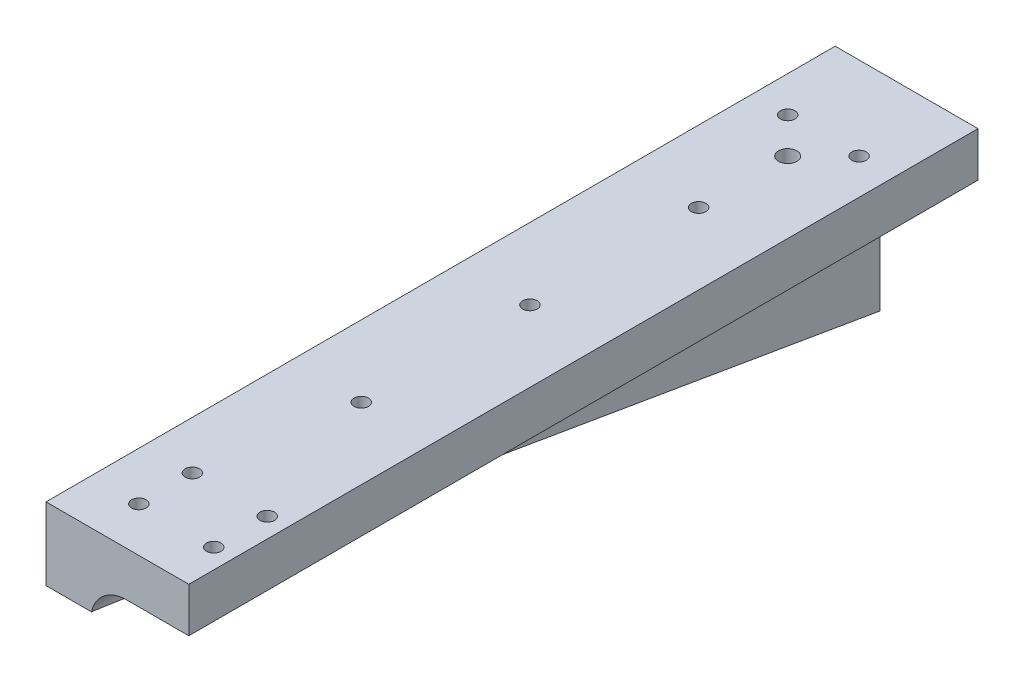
SolidWorks part; units mm, degrees
ref_plane "Front" through (0, 0, 0) normal (0, 0, 1) x (1, 0, 0)
ref_plane "Top" through (0, 0, 0) normal (0, 1, 0) x (1, 0, 0)
ref_plane "Right" through (0, 0, 0) normal (1, 0, 0) x (0, 0, -1)
sketch "Sketch1" plane through (0, 0, 0) normal (0, 0, 1) x (1, 0, 0)
  line L1 (-12.7, 3.9624) -> (12.7, 3.9624)
  line L2 (-12.7, 3.9624) -> (-12.7, -3.9751)
  line L3 (-12.7, -3.9751) -> (12.7, -3.9751)
  line L4 (12.7, 3.9624) -> (12.7, -3.9751)
  point P4 (0, -3.9751)
  dimension "D1" = 7.9375
  dimension "D2" = 25.4
  dimension "D3" = 3.9624
extrude "Extrude1" add sketch "Sketch1" along normal blind 169.545
sketch "Sketch2" plane through (0, 0, 0) normal (0, 0, -1) x (-1, 0, 0)
  line L0 (-12.7, 3.9624) -> (12.7, 3.9624) construction
  line L1 (-9.0043, 3.9624) -> (9.0043, 3.9624)
  line L2 (-9.0043, 3.9624) -> (-9.0043, 2.6924)
  line L3 (-9.0043, 2.6924) -> (9.0043, 2.6924)
  line L4 (9.0043, 3.9624) -> (9.0043, 2.6924)
  point P4 (0, 2.6924)
  dimension "D1" = 1.27
  dimension "D2" = 18.0086
extrude "Cut-Extrude1" [suppressed] cut sketch "Sketch2" against normal through all
sketch "Sketch3" plane through (-12.7, 0, 0) normal (-1, 0, 0) x (0, 0, 1)
  line L0 (0, -3.9751) -> (0, -32.8676)
  line L1 (0, -32.8676) -> (169.545, -3.9751)
  line L2 (169.545, -3.9751) -> (0, -3.9751)
  line L3 (169.545, 3.9624) -> (0, 3.9624) construction
  dimension "D1" = 36.83
extrude "Extrude2" add sketch "Sketch3" against normal blind 7.9375
fillet "Fillet1" radius 6.35 1 edges
hole_wizard "#8-32 Tapped Hole1" positions "Sketch5" profile "Sketch4" tap size "#8-32" standard "Ansi Inch"
sketch "Sketch5" plane through (0, 0, 0) normal (0, 0, -1) x (-1, 0, 0)
  line L1 (-12.7, -3.9751) -> (-12.7, 3.9624) construction
  line L2 (4.7625, -32.8676) -> (12.7, -32.8676) construction
  line L3 (12.7, 3.9624) -> (12.7, -32.8676) construction
  point P0 (8.7376, 0)
  point P1 (8.7376, -25.2476)
  point P2 (-8.7376, 0)
  dimension "D1" = 3.9624
  dimension "D2" = 7.62
  dimension "D3" = 3.9624
sketch "Sketch4" plane through (-8.7376, 0, 0) normal (1, 0, 0) x (0, 1, 0)
  line L0 (0, 0) -> (0, 10.7086)
  line L1 (0, 10.7086) -> (1.7272, 10.7086)
  line L2 (1.7272, 10.7086) -> (1.7272, 0)
  line L5 (1.7272, 0) -> (0, 0)
  line L10 (0, 10.7086) -> (-1.7272, 10.7086) construction
  line L11 (0, -6.35) -> (0, 107.95) construction
  dimension "Tap Drill Dia." = 3.4544
  dimension "Tap Drill Depth" = 10.7086
  dimension "Drill Angle" = 180
hole_wizard "#5-40 Tapped Hole1" positions "Sketch7" profile "Sketch6" tap size "#5-40" standard "Ansi Inch"
sketch "Sketch7" plane through (-12.7, 0, 0) normal (-1, 0, 0) x (0, 0, 1)
  point P0 (6.5456, -4.4958)
  dimension "D1" = 6.5456
  dimension "D2" = 4.4958
sketch "Sketch6" plane through (-12.7, -4.4958, 6.5456) normal (0, 1, 0) x (0, 0, 1)
  line L0 (0, 0) -> (0, 11.5695)
  line L1 (0, 11.5695) -> (1.289, 10.795)
  line L2 (1.289, 10.795) -> (1.289, 0)
  line L5 (1.289, 0) -> (0, 0)
  line L10 (0, 11.5695) -> (-1.2891, 10.795) construction
  line L11 (0, -6.35) -> (0, 107.95) construction
  dimension "Tap Drill Dia." = 2.5781
  dimension "Tap Drill Depth" = 10.795
  dimension "Drill Angle" = 118
hole_wizard "#5-40 Tapped Hole2" positions "Sketch9" profile "Sketch8" tap size "#5-40" standard "Ansi Inch"
sketch "Sketch9" plane through (0, 3.9624, 0) normal (0, 1, 0) x (-1, 0, 0)
  line L0 (-9.2075, 132.445) -> (4.1275, 132.445) construction
  line L1 (4.1275, 132.445) -> (4.1275, 122.92) construction
  line L2 (4.1275, 122.92) -> (-9.2075, 122.92) construction
  line L3 (-9.2075, 122.92) -> (-9.2075, 132.445) construction
  line L5 (-12.7, 169.545) -> (-12.7, 0) construction
  line L8 (-12.7, 169.545) -> (12.7, 169.545) construction
  point P0 (-9.2075, 132.445)
  point P1 (4.1275, 132.445)
  point P2 (4.1275, 122.92)
  point P3 (-9.2075, 122.92)
  dimension "D1" = 9.525
  dimension "D2" = 13.335
  dimension "D3" = 3.4925
  dimension "D4" = 37.1
sketch "Sketch8" plane through (9.2075, 3.9624, 132.445) normal (1, 0, 0) x (0, 0, 1)
  line L0 (0, 0) -> (0, 36.83)
  line L1 (0, 36.83) -> (1.289, 36.83)
  line L2 (1.289, 36.83) -> (1.289, 0)
  line L5 (1.289, 0) -> (0, 0)
  line L11 (0, -6.35) -> (0, 107.95) construction
  dimension "Thru Tap Drill Dia." = 2.5781
  dimension "Thru Tap Drill Depth" = 36.83
hole_wizard "#5-40 Tapped Hole3" positions "Sketch11" profile "Sketch10" tap size "#5-40" standard "ANSI Inch"
sketch "Sketch11" plane through (0, 3.9624, 0) normal (0, 1, 0) x (-1, 0, 0)
  line L1 (0, 96.9972) -> (0, 66.9972) construction
  line L2 (0, 66.9972) -> (0, 36.9972) construction
  point P0 (0, 36.9972)
  point P1 (0, 66.9972)
  point P2 (0, 96.9972)
  dimension "D1" = 36.9972
  dimension "D2" = 30
sketch "Sketch10" plane through (0, 3.9624, 36.9972) normal (1, 0, 0) x (0, 0, 1)
  line L0 (0, 0) -> (0, 36.83)
  line L1 (0, 36.83) -> (1.289, 36.83)
  line L2 (1.289, 36.83) -> (1.289, 0)
  line L5 (1.289, 0) -> (0, 0)
  line L11 (0, -6.35) -> (0, 107.95) construction
  dimension "Thru Tap Drill Dia." = 2.5781
  dimension "Thru Tap Drill Depth" = 36.83
hole_wizard "3/16 (0.187500) Diameter Hole1" positions "Sketch15" profile "Sketch14" hole size "3/16" standard "Ansi Inch"
sketch "Sketch15" plane through (0, 0, 0) normal (0, 0, -1) x (-1, 0, 0)
  line L0 (-8.7376, 0) -> (8.7376, 0) construction
  line L1 (8.7376, 0) -> (8.7376, -25.2476) construction
  circle A0 centre (-8.7376, 0) radius 1.7272 construction
  circle A1 centre (8.7376, -25.2476) radius 1.7272 construction
  circle A2 centre (8.7376, 0) radius 1.7272 construction
  point P0 (8.7376, -12.6238)
  point P1 (0, 0)
sketch "Sketch14" plane through (-8.7376, -12.6238, 0) normal (1, 0, 0) x (0, 1, 0)
  line L0 (0, 0) -> (0, 7.7884)
  line L1 (0, 7.7884) -> (2.3939, 6.35)
  line L2 (2.3939, 6.35) -> (2.3939, 0)
  line L5 (2.3939, 0) -> (0, 0)
  line L10 (0, 7.7884) -> (-2.394, 6.35) construction
  line L11 (0, -6.35) -> (0, 107.95) construction
  dimension "Hole Dia." = 4.7879
  dimension "Hole Depth" = 6.35
  dimension "Drill Angle" = 118
hole_wizard "#5-40 Tapped Hole4" positions "Sketch17" profile "Sketch16" tap size "#5-40" standard "Ansi Inch"
sketch "Sketch17" plane through (0, 3.9624, 0) normal (0, 1, 0) x (-1, 0, 0)
  line L0 (6.35, 15.4432) -> (6.35, 14.1732) construction
  line L1 (-6.35, 15.4432) -> (-6.35, 14.1732) construction
  arc A2 (-4.6228, 15.4432) -> (-8.0772, 15.4432) centre (-6.35, 15.4432) ccw construction
  arc A3 (-8.0772, 14.1732) -> (-4.6228, 14.1732) centre (-6.35, 14.1732) ccw construction
  arc A4 (8.0772, 15.4432) -> (4.6228, 15.4432) centre (6.35, 15.4432) ccw construction
  arc A5 (4.6228, 14.1732) -> (8.0772, 14.1732) centre (6.35, 14.1732) ccw construction
  point P0 (6.35, 14.8082)
  point P1 (-6.35, 14.8082)
sketch "Sketch16" plane through (-6.35, 3.9624, 14.8082) normal (1, 0, 0) x (0, 0, 1)
  line L0 (0, 0) -> (0, 10.795)
  line L1 (0, 10.795) -> (1.289, 10.795)
  line L2 (1.289, 10.795) -> (1.289, 0)
  line L5 (1.289, 0) -> (0, 0)
  line L10 (0, 10.795) -> (-1.2891, 10.795) construction
  line L11 (0, -6.35) -> (0, 107.95) construction
  dimension "Tap Drill Dia." = 2.5781
  dimension "Tap Drill Depth" = 10.795
  dimension "Drill Angle" = 180
hole_wizard "3/32 (0.09375) Diameter Hole1" positions "Sketch19" profile "Sketch18" hole size "3/32" standard "Ansi Inch"
sketch "Sketch19" plane through (-12.7, 0, 0) normal (-1, 0, 0) x (0, 0, 1)
  point P0 (6.5456, -16.4338)
  dimension "D1" = 6.5456
  dimension "D2" = 16.4338
sketch "Sketch18" plane through (-12.7, -16.4338, 6.5456) normal (0, 1, 0) x (0, 0, 1)
  line L0 (0, 0) -> (0, 3.81)
  line L1 (0, 3.81) -> (1.1906, 3.81)
  line L2 (1.1906, 3.81) -> (1.1906, 0)
  line L5 (1.1906, 0) -> (0, 0)
  line L10 (0, 3.81) -> (-1.1906, 3.81) construction
  line L11 (0, -6.35) -> (0, 107.95) construction
  dimension "Hole Dia." = 2.3812
  dimension "Hole Depth" = 3.81
  dimension "Drill Angle" = 180
ref_plane "Plane1" [suppressed] through (0, 0, 9.525) normal (0, 0, -1) x (-1, 0, 0)
sketch "Sketch20" [suppressed] plane through (0, 0, 9.525) normal (0, 0, -1) x (-1, 0, 0)
  line L1 (12.7, 3.9624) -> (-14.6815, 3.9624)
  line L2 (12.7, 3.9624) -> (12.7, -34.3505)
  line L3 (12.7, -34.3505) -> (-14.6815, -34.3505)
  line L4 (-14.6815, 3.9624) -> (-14.6815, -34.3505)
extrude "Cut-Extrude2" [suppressed] cut sketch "Sketch20" against normal through all
sketch "Sketch22" [suppressed] plane through (0, 3.9624, 0) normal (0, 1, 0) x (-1, 0, 0)
  line L0 (12.7, 9.525) -> (12.7, 0) construction
  line L1 (-12.7, 0) -> (12.7, 0)
  line L2 (-12.7, 0) -> (-12.7, 4.2565)
  line L3 (-12.7, 4.2565) -> (12.7, 4.2565)
  line L4 (12.7, 0) -> (12.7, 4.2565)
extrude "Extrude3" [suppressed] add sketch "Sketch22" along normal blind 45.72
sketch "Sketch23" plane through (0, 0, 169.545) normal (0, 0, 1) x (1, 0, 0)
  line L1 (-12.7, 3.9624) -> (19.8862, 3.9624)
  line L2 (-12.7, 3.9624) -> (-12.7, -38.3366)
  line L3 (-12.7, -38.3366) -> (19.8862, -38.3366)
  line L4 (19.8862, 3.9624) -> (19.8862, -38.3366)
extrude "Cut-Extrude4" [suppressed] cut sketch "Sketch23" against normal up to surface (23.3618 mm away)
hole_wizard "#5 Clearance Hole1" positions "Sketch25" profile "Sketch24" hole size "#5" standard "ANSI Inch"
sketch "Sketch25" plane through (0, 3.9624, 0) normal (0, 1, 0) x (1, 0, 0)
  circle A0 centre (6.35, -14.8082) radius 1.289 construction
  circle A1 centre (-6.35, -14.8082) radius 1.289 construction
  point P0 (0, -21.1582)
  dimension "D2" = 6.35
  dimension "D1" = 6.35
sketch "Sketch24" plane through (0, 3.9624, 21.1582) normal (1, 0, 0) x (0, 0, 1)
  line L0 (0, 0) -> (0, 20.0306)
  line L1 (0, 20.0306) -> (1.6319, 19.05)
  line L2 (1.6319, 19.05) -> (1.6319, 0)
  line L5 (1.6319, 0) -> (0, 0)
  line L10 (0, 20.0306) -> (-1.632, 19.05) construction
  line L11 (0, -6.35) -> (0, 107.95) construction
  dimension "Hole Dia." = 3.2639
  dimension "Hole Depth" = 19.05
  dimension "Drill Angle" = 118
sketch "Sketch26" plane through (0, 3.9624, 0) normal (0, 1, 0) x (1, 0, 0)
  line L0 (-12.7, -169.545) -> (-12.7, 0) construction
  line L1 (12.7, -169.545) -> (-12.7, -169.545)
  line L2 (12.7, -169.545) -> (12.7, -140.3825)
  line L3 (12.7, -140.3825) -> (-12.7, -140.3825)
  line L4 (-12.7, -169.545) -> (-12.7, -140.3825)
  line L5 (12.7, -169.545) -> (-12.7, -169.545) construction
  line L6 (12.7, -169.545) -> (12.7, 0) construction
  dimension "D1" = 29.1625
extrude "Cut-Extrude5" cut sketch "Sketch26" against normal up to next
